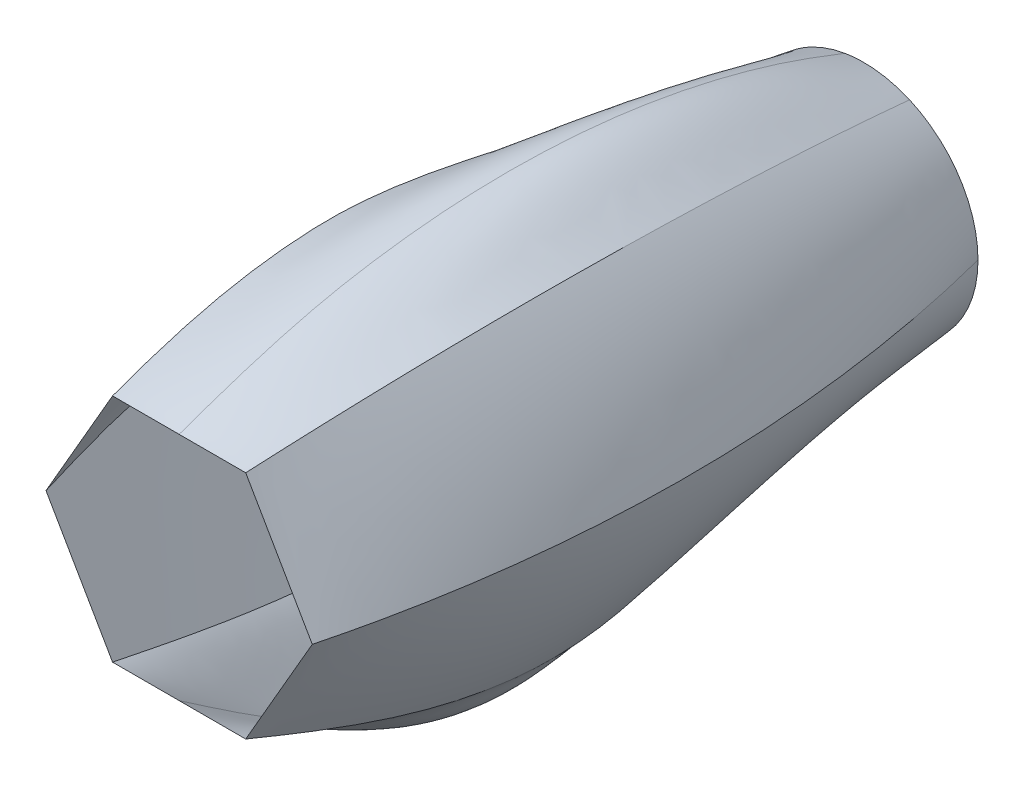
SolidWorks part; units mm, degrees
ref_plane "Front" through (0, 0, 0) normal (0, 0, 1) x (1, 0, 0)
ref_plane "Top" through (0, 0, 0) normal (0, 1, 0) x (1, 0, 0)
ref_plane "Right" through (0, 0, 0) normal (1, 0, 0) x (0, 0, -1)
sketch "Sketch1" plane through (0, 0, 0) normal (0, 1, 0) x (1, 0, 0)
  arc A0 (25, 0) -> (25, 125) centre (-217.0615, 62.5) ccw
  dimension "D3" = 250
  dimension "D1" = 25
  dimension "D2" = 125
ref_plane "Plane1" through (0, 0, -125) normal (0, 0, 1) x (1, 0, 0)
sketch "Sketch5" plane through (0, 0, -125) normal (0, 0, 1) x (1, 0, 0)
  circle A0 centre (3.5882, 0) radius 21.4118
sketch "Sketch4" plane through (0, 0, 0) normal (0, 0, 1) x (1, 0, 0)
  line L1 (25, 0) -> (12.5, 21.6506)
  line L2 (12.5, 21.6506) -> (-12.5, 21.6506)
  line L3 (-12.5, 21.6506) -> (-25, 0)
  line L4 (-25, 0) -> (-12.5, -21.6506)
  line L5 (-12.5, -21.6506) -> (12.5, -21.6506)
  line L6 (12.5, -21.6506) -> (25, 0)
  circle A0 centre (0, 0) radius 21.6506 construction
sketch "Sketch9" plane through (0, 0, 0) normal (1, 0, 0) x (0, 0, -1)
  spline_without_curve S0
sketch "Sketch8" plane through (0, 0, 0) normal (1, 0, 0) x (0, 0, -1)
  arc A0 (0, 21.6506) -> (125, 21.109) centre (61.8267, -134.0181) cw
sketch "Sketch6" plane through (0, 0, 0) normal (0, 1, 0) x (1, 0, 0)
  spline_without_curve S0
surface "Surface-Loft4"
